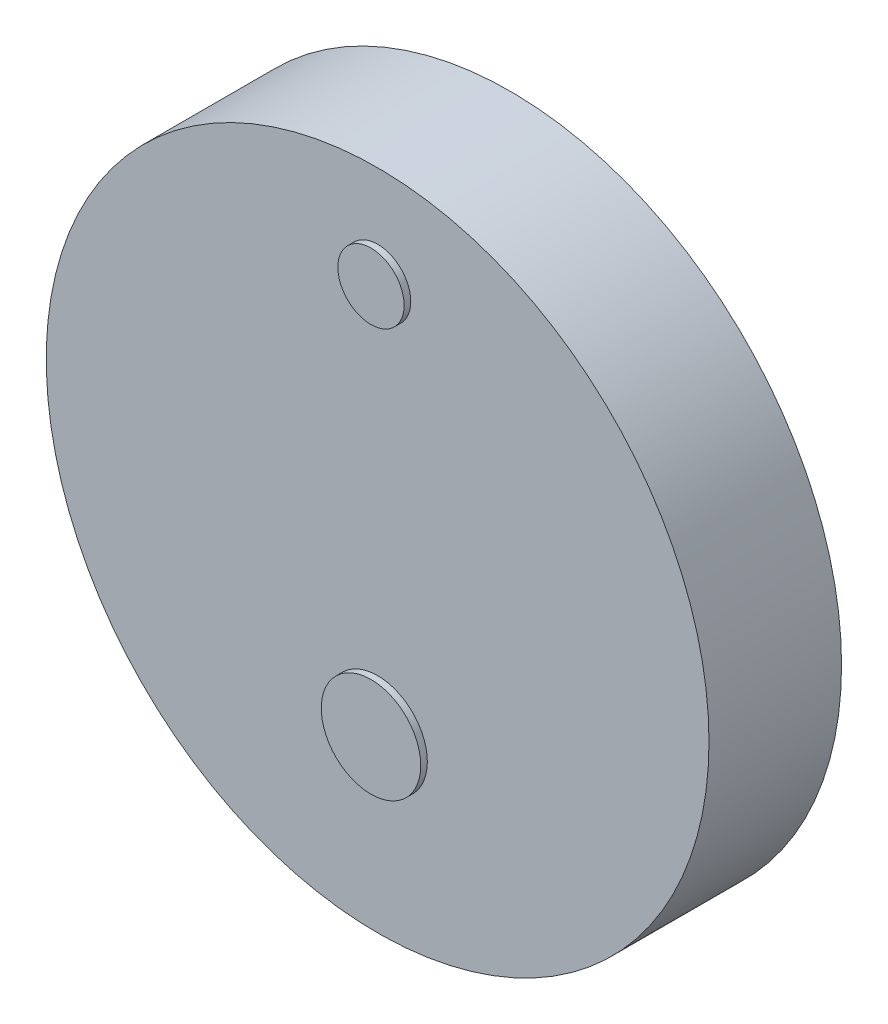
SolidWorks part; units mm, degrees
ref_plane "Alzado" through (0, 0, 0) normal (0, 0, 1) x (1, 0, 0)
ref_plane "Planta" through (0, 0, 0) normal (0, 1, 0) x (1, 0, 0)
ref_plane "Vista lateral" through (0, 0, 0) normal (1, 0, 0) x (0, 0, -1)
sketch "Croquis1" plane through (0, 0, 0) normal (0, 0, 1) x (1, 0, 0)
  circle A0 centre (0, 0) radius 50
  dimension "D1" = 100
extrude "Saliente-Extruir1" add sketch "Croquis1" along normal blind 20
sketch "Croquis2" plane through (0, 0, 20) normal (0, 0, 1) x (1, 0, 0)
  circle A0 centre (0, 35) radius 5
  circle A1 centre (0, 0) radius 50 construction
  dimension "D1" = 35
  dimension "D2" = 10
extrude "Saliente-Extruir2" add sketch "Croquis2" along normal blind 1
sketch "Croquis3" plane through (0, 0, 20) normal (0, 0, 1) x (1, 0, 0)
  circle A0 centre (0, -23.8719) radius 7.5
  dimension "D1" = 15
extrude "Saliente-Extruir3" add sketch "Croquis3" along normal blind 1 separate body
